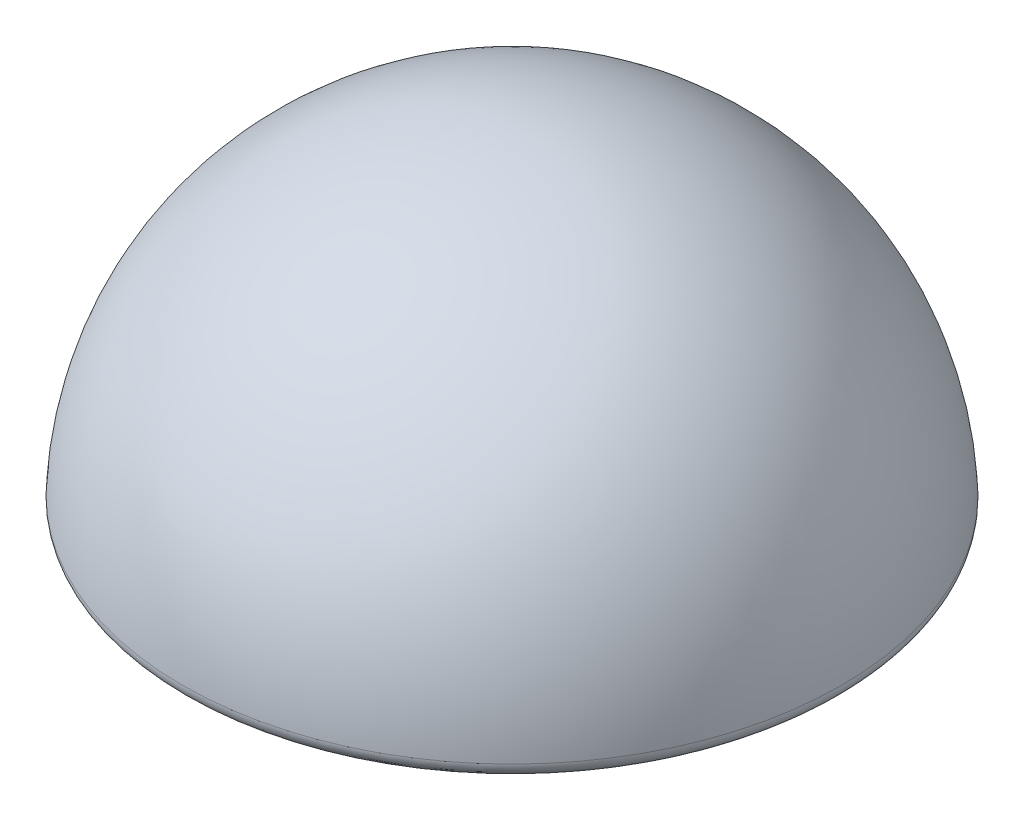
SolidWorks part; units mm, degrees
ref_plane "Front Plane" through (0, 0, 0) normal (0, 0, 1) x (1, 0, 0)
ref_plane "Top Plane" through (0, 0, 0) normal (0, 1, 0) x (1, 0, 0)
ref_plane "Right Plane" through (0, 0, 0) normal (1, 0, 0) x (0, 0, -1)
sketch "Sketch1" plane through (0, 0, 0) normal (0, 0, 1) x (1, 0, 0)
  line L0 (0, 0) -> (0, 45)
  line L1 (0, 0) -> (45, 0)
  arc A0 (0, 45) -> (45, 0) centre (0, 0) cw
  dimension "D3" = 45
  dimension "D1" = 45
  dimension "D2" = 45
revolve "Revolve1" add sketch "Sketch1" angle 360 about L0
sketch "Sketch2" plane through (0, 0, 0) normal (0, -1, 0) x (1, 0, 0)
  circle A0 centre (0, 0) radius 12.25
  dimension "D1" = 24.5
extrude "Cut-Extrude1" cut sketch "Sketch2" against normal blind 16
fillet "Fillet3" radius 2 1 edges at (0, 0, -45)
